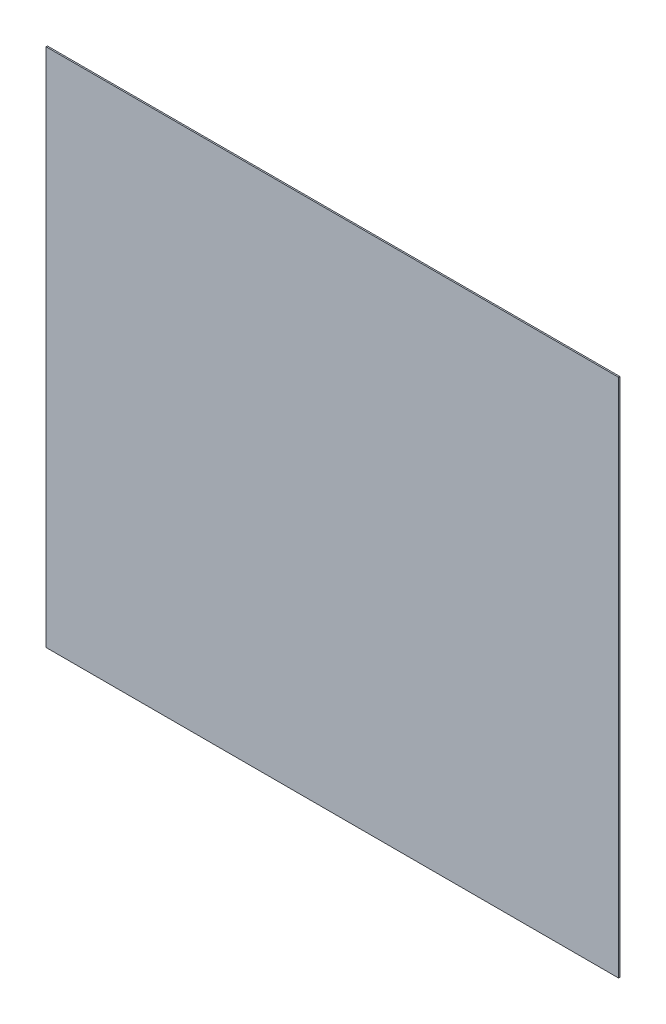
SolidWorks part; units mm, degrees
ref_plane "Plan de face" through (0, 0, 0) normal (0, 0, 1) x (1, 0, 0)
ref_plane "Plan de dessus" through (0, 0, 0) normal (0, 1, 0) x (1, 0, 0)
ref_plane "Plan de droite" through (0, 0, 0) normal (1, 0, 0) x (0, 0, -1)
sketch "Model" plane through (0, 0, 0) normal (0, 0, 1) x (1, 0, 0)
  line L0 (1032.3846, 654.3047) -> (822.3846, 654.3047)
  line L1 (822.3846, 654.3047) -> (822.3846, 464.3047)
  line L2 (822.3846, 464.3047) -> (1032.3846, 464.3047)
  line L3 (1032.3846, 464.3047) -> (1032.3846, 654.3047)
  line L4 (1302.0636, 362.1494) -> (1143.0636, 362.1494)
  line L5 (1143.0636, 362.1494) -> (1143.0636, 247.1494)
  line L6 (1143.0636, 247.1494) -> (1302.0636, 247.1494)
  line L7 (1302.0636, 247.1494) -> (1302.0636, 362.1494)
  line L8 (1290.7747, 654.3047) -> (1131.7747, 654.3047)
  line L9 (1131.7747, 654.3047) -> (1131.7747, 464.3047)
  line L10 (1131.7747, 464.3047) -> (1290.7747, 464.3047)
  line L11 (1290.7747, 464.3047) -> (1290.7747, 654.3047)
  line L12 (1023.1433, 413.8035) -> (813.1433, 413.8035)
  line L13 (813.1433, 413.8035) -> (813.1433, 211.8035)
  line L14 (813.1433, 211.8035) -> (1023.1433, 211.8035)
  line L15 (1023.1433, 211.8035) -> (1023.1433, 413.8035)
extrude "Boss.-Extru.1" add sketch "Model" along normal blind 0.5 contours L2 L3 L0 L1
sketch "Esquisse1" plane through (0, 0, 0.5) normal (0, 0, 1) x (1, 0, 0)
  line L0 (822.3846, 654.3047) -> (822.3846, 464.3047) construction
  line L1 (806.9984, 659.7026) -> (823.3846, 659.7026)
  line L2 (806.9984, 659.7026) -> (806.9984, 459.427)
  line L3 (806.9984, 459.427) -> (823.3846, 459.427)
  line L4 (823.3846, 659.7026) -> (823.3846, 459.427)
  dimension "D1" = 1
extrude "Enlèv. mat.-Extru.1" cut sketch "Esquisse1" against normal through all
